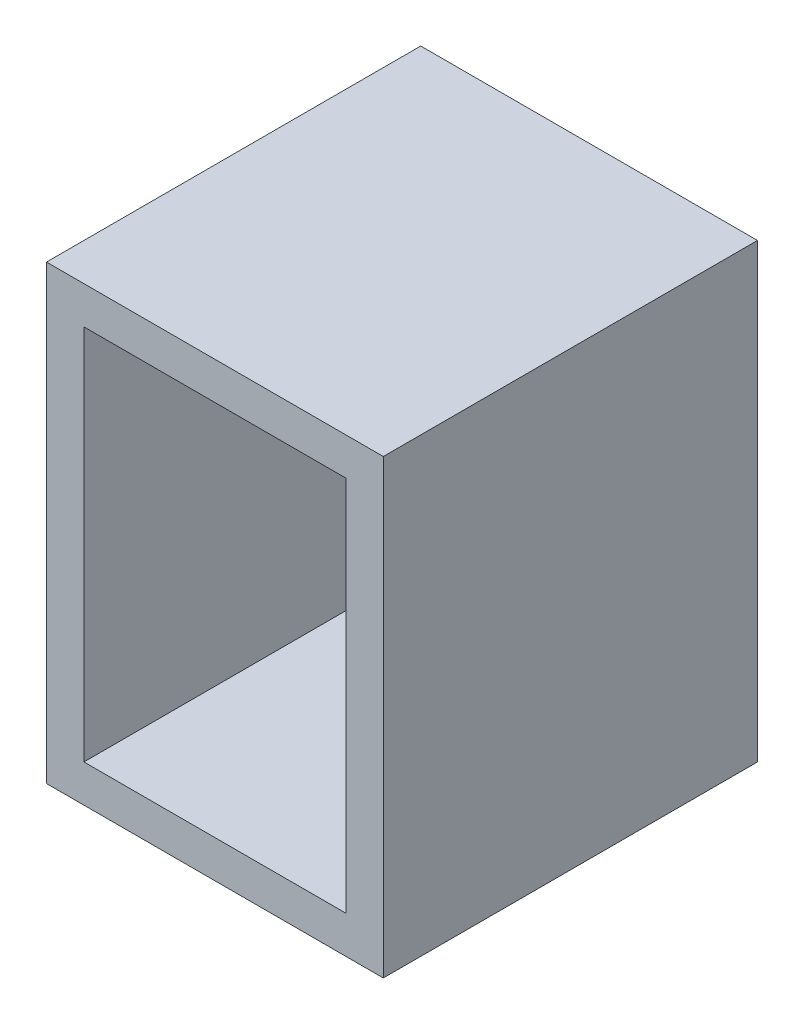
SolidWorks part; units mm, degrees
ref_plane "Front Plane" through (0, 0, 0) normal (0, 0, 1) x (1, 0, 0)
ref_plane "Top Plane" through (0, 0, 0) normal (0, 1, 0) x (1, 0, 0)
ref_plane "Right Plane" through (0, 0, 0) normal (1, 0, 0) x (0, 0, -1)
sketch "Sketch1" plane through (0, 0, 0) normal (0, 0, 1) x (1, 0, 0)
  line L0 (-17.5, 25.173) -> (17.5, -25.173) construction
  line L1 (-17.5, 25.173) -> (17.5, 25.173)
  line L2 (-17.5, 25.173) -> (-17.5, -25.173)
  line L3 (-17.5, -25.173) -> (17.5, -25.173)
  line L4 (17.5, 25.173) -> (17.5, -25.173)
  dimension "D1" = 35
  dimension "D2" = 50.346
extrude "Extrude1" add sketch "Sketch1" along normal mid plane 50
shell "Shell1" thickness 5
